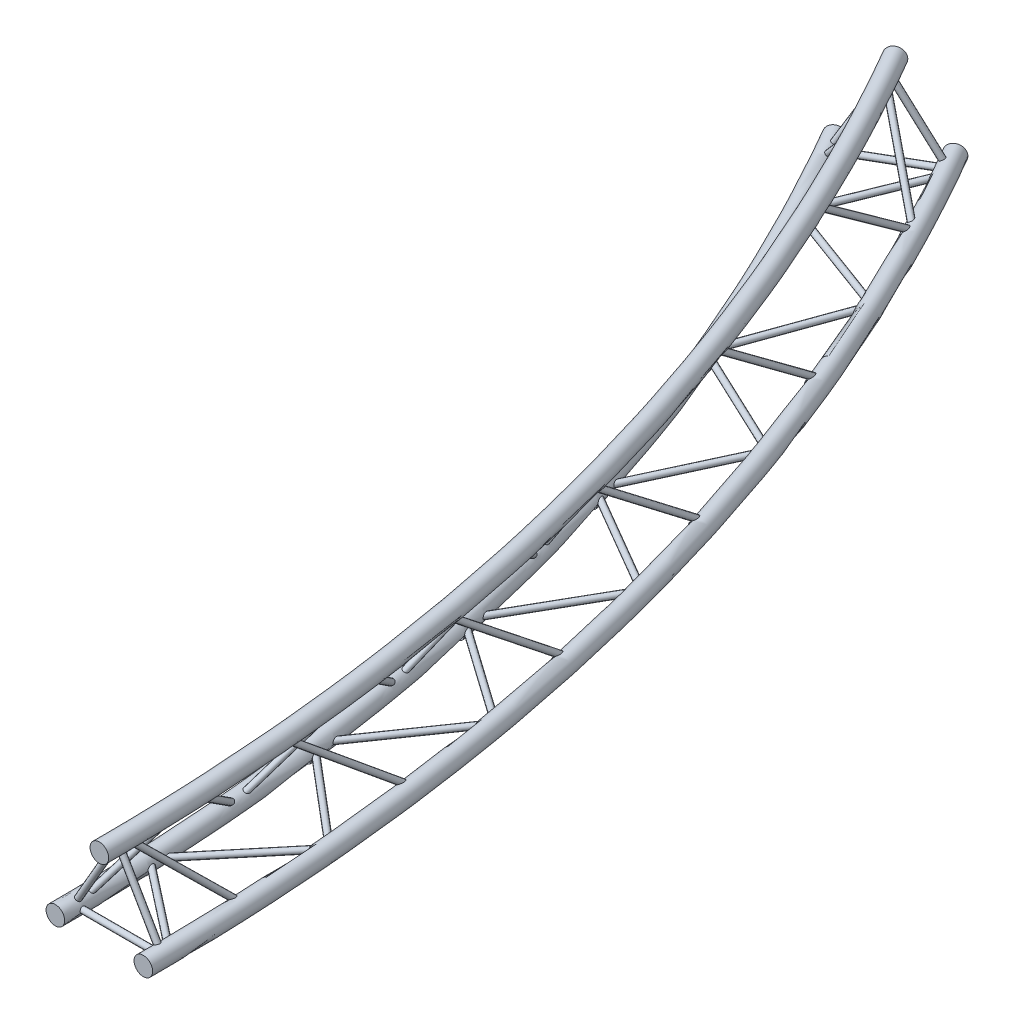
SolidWorks part; units mm, degrees
ref_plane "Face" through (0, 0, 0) normal (0, 0, 1) x (1, 0, 0)
ref_plane "Dessus" through (0, 0, 0) normal (0, 1, 0) x (1, 0, 0)
ref_plane "Droite" through (0, 0, 0) normal (1, 0, 0) x (0, 0, -1)
sketch "Esquisse1" plane through (0, 0, 0) normal (0, 0, 1) x (1, 0, 0)
  line L0 (5856.5, 136.832) -> (5738, -68.416) construction
  line L1 (5738, -68.416) -> (5975, -68.416) construction
  line L2 (5975, -68.416) -> (5856.5, 136.832) construction
  line L3 (5856.5, 61.5908) -> (5856.5, -61.5908) construction
  line L4 (72.9361, 0) -> (11640.0639, 0) construction
  line L5 (5856.5, 0) -> (5856.5, 136.832)
  line L8 (6000, -68.416) -> (6000, 207.9766) construction
  line L9 (0, 252.4415) -> (0, -235.2114) construction
  circle A0 centre (5856.5, 0) radius 136.832 construction
  circle A1 centre (5856.5, 136.832) radius 25
  circle A2 centre (5738, -68.416) radius 25
  circle A3 centre (5975, -68.416) radius 25
  dimension "D1" = 90
  dimension "D2" = 50
  dimension "D3" = 237
  dimension "D4" = 6000
revolve "Révolution1" add sketch "Esquisse1" angle 30 about L9
ref_point "Point1"
ref_plane "Plan1" through (0, -68.416, 0) normal (0, 1, 0) x (-1, 0, 0)
sketch "cercle1" plane through (0, -68.416, 0) normal (0, 1, 0) x (-1, 0, 0)
  circle A0 centre (0, 0) radius 5738
ref_point "Point2"
ref_plane "Plan2" through (0, -68.416, 0) normal (0, 1, 0) x (-1, 0, 0)
sketch "cercle2" plane through (0, -68.416, 0) normal (0, 1, 0) x (-1, 0, 0)
  circle A0 centre (0, 0) radius 5975
ref_point "Point3"
ref_plane "Plan3" through (0, 136.832, 0) normal (0, 1, 0) x (-1, 0, 0)
sketch "cercle3" plane through (0, 136.832, 0) normal (0, 1, 0) x (-1, 0, 0)
  circle A0 centre (0, 0) radius 5856.5
ref_point "Point4"
ref_plane "Plan4" through (0, 0, 0) normal (0, 1, 0) x (-1, 0, 0)
sketch "cercle4" plane through (0, 0, 0) normal (0, 1, 0) x (-1, 0, 0)
  circle A0 centre (0, 0) radius 5856.5
ref_plane "plan_sym" through (0, 0, 0) normal (0.2588, 0, 0.9659) x (0.9659, 0, -0.2588)
sketch3d "Esquisse3D1"
  line L0 (5856.2866, 136.832, -49.9995) -> (5737.7821, -68.416, -50)
  line L1 (5737.7821, -68.416, -50) -> (5974.7908, -68.416, -49.9996)
  line L2 (5974.7908, -68.416, -49.9996) -> (5856.2866, 136.832, -49.9995)
  line L3 (5738, -68.416, 0) -> (5975, -68.416, 0) construction
  circle A0 centre (0, 136.832, 0) radius 5856.5 construction
  circle A1 centre (0, -68.416, 0) radius 5738 construction
  circle A2 centre (0, -68.416, 0) radius 5975 construction
  circle A3 centre (5856.5, 136.832, 0) radius 25 construction
  point P4 (0, 5993.332, 0)
  point P7 (0, 5669.584, 0)
  point P11 (0, 5906.584, 0)
  point P14 (5856.5, 136.832, 25)
  dimension "D1" = 50
  dimension "D2" = 50
  dimension "D3" = 50
ref_plane "Plan6" through (5737.7821, -68.416, -50) normal (-0.5, -0.866, 0) x (0.866, -0.5, -0.0001)
sketch "Esquisse8" plane through (5737.7821, -68.416, -50) normal (-0.5, -0.866, 0) x (0.866, -0.5, -0.0001)
  circle A0 centre (0, 0) radius 8
sweep "treilli droit départ" add profiles "Esquisse8" path "Esquisse3D1"
mirror "treilli droit fin" about plane through (0, 0, 0) normal (0.2588, 0, 0.9659) of "treilli droit départ"
sketch3d "Esquisse3D2"
  line L0 (5974.59, -68.416, -69.9988) -> (5732.1081, -68.416, -259.963)
  line L1 (5738, -68.416, 0) -> (5975, -68.416, 0) construction
  circle A0 centre (0, -68.416, 0) radius 5975 construction
  circle A1 centre (0, -68.416, 0) radius 5738 construction
  point P4 (0, 5906.584, 0)
  point P7 (0, 5669.584, 0)
  dimension "D1" = 70
  dimension "D2" = 259.963
ref_plane "Plan7" through (5732.1081, -68.416, -259.963) normal (-0.7872, 0, -0.6167) x (-0.6167, 0, 0.7872)
sketch "Esquisse9" plane through (5732.1081, -68.416, -259.963) normal (-0.7872, 0, -0.6167) x (-0.6167, 0, 0.7872)
  circle A0 centre (0, 0) radius 8
  dimension "D1" = 16
sweep "treilli depart 1" add profiles "Esquisse9" path "Esquisse3D2"
sketch3d "Esquisse3D3"
  line L0 (5737.573, -68.416, -69.9987) -> (5850.7303, 136.832, -259.899)
  circle A0 centre (0, -68.416, 0) radius 5738 construction
  circle A1 centre (0, 136.832, 0) radius 5856.5 construction
  point P4 (0, 5669.584, 0)
  point P7 (0, 5993.332, 0)
  dimension "D1" = 70
  dimension "D2" = 259.963
ref_plane "Plan8" through (5737.573, -68.416, -69.9987) normal (0.3751, 0.6804, -0.6295) x (-0.9257, 0.311, -0.2155)
sketch "Esquisse10" plane through (5737.573, -68.416, -69.9987) normal (0.3751, 0.6804, -0.6295) x (-0.9257, 0.311, -0.2155)
  circle A0 centre (0, 0) radius 8
  dimension "D1" = 16
sweep "treilli depart 2" add profiles "Esquisse10" path "Esquisse3D3"
sketch3d "Esquisse3D4"
  line L0 (5856.0817, 136.832, -69.9987) -> (5968.4411, -68.416, -279.8862)
  circle A0 centre (0, 136.832, 0) radius 5856.5 construction
  circle A1 centre (0, -68.416, 0) radius 5975 construction
  point P4 (0, 5993.332, 0)
  point P7 (0, 5906.584, 0)
  dimension "D1" = 279.963
  dimension "D2" = 70
ref_plane "Plan9" through (5968.4411, -68.416, -279.8862) normal (0.3575, -0.653, -0.6677) x (0.9317, 0.2982, 0.2071)
sketch "Esquisse11" plane through (5968.4411, -68.416, -279.8862) normal (0.3575, -0.653, -0.6677) x (0.9317, 0.2982, 0.2071)
  circle A0 centre (0, 0) radius 8
  dimension "D1" = 16
sweep "treilli depart 3" add profiles "Esquisse11" path "Esquisse3D4"
mirror "treillis fin" about plane through (0, 0, 0) normal (0.2588, 0, 0.9659) of "treilli depart 1", "treilli depart 2", "treilli depart 3"
sketch3d "Esquisse3D6"
  line L0 (5850.7303, 136.832, -259.899) -> (5715.8564, -68.416, -503.6166)
  line L1 (5836.5275, 111.0705, -236.0638) -> (5747.7268, -49.9988, -87.0387) construction
  circle A0 centre (0, 136.832, 0) radius 5856.5 construction
  circle A1 centre (0, -68.416, 0) radius 5738 construction
  point P4 (0, 5993.332, 0)
  point P7 (0, 5669.584, 0)
  dimension "D1" = 346
ref_plane "Plan11" through (5715.8564, -68.416, -503.6166) normal (-0.3898, -0.5932, -0.7044) x (0.9164, -0.3254, -0.2331)
sketch "Esquisse12" plane through (5715.8564, -68.416, -503.6166) normal (-0.3898, -0.5932, -0.7044) x (0.9164, -0.3254, -0.2331)
  circle A0 centre (0, 0) radius 8
  dimension "D1" = 16
sweep "treilli int 1" add profiles "Esquisse12" path "Esquisse3D6"
ref_plane "Plan10" through (0, 0, 0) normal (0.0878, 0, 0.9961) x (0.9961, 0, -0.0878)
sketch3d "Esquisse3D7"
  line L2 (5923.4738, -68.416, -782.996) -> (5833.8991, 136.832, -514.0172)
  circle A0 centre (0, 136.832, 0) radius 5856.5 construction
  circle A1 centre (0, -68.416, 0) radius 5975 construction
  point P4 (0, 5993.332, 0)
  point P5 (0, 5906.584, 0)
  dimension "D1" = 350
ref_plane "Plan12" through (5833.8991, 136.832, -514.0172) normal (-0.2559, 0.5864, 0.7685) x (-0.5575, -0.739, 0.3783)
sketch "Esquisse13" plane through (5833.8991, 136.832, -514.0172) normal (-0.2559, 0.5864, 0.7685) x (-0.5575, -0.739, 0.3783)
  circle A0 centre (0, 0) radius 8
  dimension "D1" = 16
sweep "treilli int 2" add profiles "Esquisse13" path "Esquisse3D7"
sketch3d "Esquisse3D9"
  line L0 (5732.1081, -68.416, -259.963) -> (5951.9418, -68.416, -524.4178)
  line L1 (5954.4013, -68.416, -85.8149) -> (5762.0889, -68.416, -236.4755) construction
  circle A0 centre (0, -68.416, 0) radius 5738 construction
  circle A1 centre (0, -68.416, 0) radius 5975 construction
  point P4 (0, 5669.584, 0)
  point P7 (0, 5906.584, 0)
  dimension "D1" = 343.8941
ref_plane "Plan13" through (5732.1081, -68.416, -259.963) normal (0.6392, 0, -0.769) x (-0.769, 0, -0.6392)
sketch "Esquisse14" plane through (5732.1081, -68.416, -259.963) normal (0.6392, 0, -0.769) x (-0.769, 0, -0.6392)
  circle A0 centre (0, 0) radius 8
  dimension "D1" = 16
sweep "treilli int 3" add profiles "Esquisse14" path "Esquisse3D9"
sketch3d "Esquisse3D10"
  line L0 (5806.0359, 136.832, -767.1634) -> (5715.8564, -68.416, -503.6166)
  circle A0 centre (0, 136.832, 0) radius 5856.5 construction
  circle A1 centre (0, -68.416, 0) radius 5738 construction
  point P4 (0, 5993.332, 0)
  point P7 (0, 5669.584, 0)
  dimension "D1" = 346
ref_plane "Plan14" through (5806.0359, 136.832, -767.1634) normal (-0.2606, -0.5932, 0.7617) x (0.961, -0.0838, 0.2636)
sketch "Esquisse15" plane through (5806.0359, 136.832, -767.1634) normal (-0.2606, -0.5932, 0.7617) x (0.961, -0.0838, 0.2636)
  circle A0 centre (0, 0) radius 8
  dimension "D1" = 16
sweep "treilli int4" add profiles "Esquisse15" path "Esquisse3D10"
sketch3d "Esquisse3D11"
  line L0 (5833.8991, 136.832, -514.0172) -> (5923.4738, -68.416, -782.996)
  circle A0 centre (0, -68.416, 0) radius 5975 construction
  point P5 (0, 5906.584, 0)
  dimension "D1" = 350
ref_plane "Plan15" through (5923.4738, -68.416, -782.996) normal (0.2559, -0.5864, -0.7685) x (-0.96, -0.0604, -0.2736)
sketch "Esquisse16" plane through (5923.4738, -68.416, -782.996) normal (0.2559, -0.5864, -0.7685) x (-0.96, -0.0604, -0.2736)
  circle A0 centre (0, 0) radius 8
  dimension "D1" = 16
sweep "treilli int 5" add profiles "Esquisse16" path "Esquisse3D11"
sketch3d "Esquisse3D12"
  line L0 (5951.9418, -68.416, -524.4178) -> (5689.2525, -68.416, -746.3581)
  circle A0 centre (0, -68.416, 0) radius 5738 construction
  point P5 (0, 5669.584, 0)
  dimension "D1" = 343.8941
ref_plane "Plan16" through (5951.9418, -68.416, -524.4178) normal (-0.7639, 0, -0.6454) x (-0.6454, 0, 0.7639)
sketch "Esquisse17" plane through (5951.9418, -68.416, -524.4178) normal (-0.7639, 0, -0.6454) x (-0.6454, 0, 0.7639)
  circle A0 centre (0, 0) radius 8
  dimension "D1" = 16
sweep "treilli int 6" add profiles "Esquisse17" path "Esquisse3D12"
sketch "Esquisse19" plane through (0, 0, 0) normal (0, 1, 0) x (1, 0, 0)
  line L0 (5715.8564, 503.6166) -> (0, 0)
  line L1 (0, 0) -> (5850.7303, 259.899)
  line L2 (5836.5275, 236.0638) -> (5747.7268, 87.0387) construction
  line L3 (-267.1741, -23.5404) -> (267.1741, 23.5404) construction
  line L4 (5833.3914, 291.2305) -> (5733.2215, 472.2378) construction
  circle A1 centre (0, 0) radius 5738 construction
  circle A2 centre (0, 0) radius 5856.5 construction
  dimension "D1" = 2.492
pattern_circular "Répétition circulaire1" count 5 every 4.984 of "treilli int 1", "treilli int 3", "treilli int 2"
pattern_circular "Répétition circulaire2" count 5 every 4.984 of "treilli int4", "treilli int 6", "treilli int 5"
sketch3d "Esquisse3D13"
  line L0 (5106.5155, 136.832, -2867.419) -> (5094.1327, -68.416, -2640.9195)
  circle A0 centre (0, 136.832, 0) radius 5856.5 construction
  circle A1 centre (0, -68.416, 0) radius 5738 construction
  point P4 (0, 5993.332, 0)
  point P7 (0, 5669.584, 0)
  dimension "D1" = 259.963
  dimension "D2" = 70
ref_plane "Plan17" through (5106.5155, 136.832, -2867.419) normal (-0.0405, -0.6709, 0.7404) x (0.7399, 0.4779, 0.4735)
sketch "Esquisse21" plane through (5106.5155, 136.832, -2867.419) normal (-0.0405, -0.6709, 0.7404) x (0.7399, 0.4779, 0.4735)
  circle A0 centre (0, 0) radius 8
  dimension "D1" = 16
sweep "treilli sym 1" [suppressed] add profiles "Esquisse21" path "Esquisse3D13"
sketch3d "Esquisse3D14"
  line L0 (5206.0608, 136.832, -2682.4472) -> (5209.1467, -68.416, -2926.6732)
  circle A0 centre (0, 136.832, 0) radius 5856.5 construction
  circle A1 centre (0, -68.416, 0) radius 5975 construction
  point P4 (0, 5993.332, 0)
  point P7 (0, 5906.584, 0)
  dimension "D1" = 70
  dimension "D2" = 279.963
ref_plane "Plan18" [suppressed] through (-972.4839, -68.416, -70) normal (-0.4895, -0.6544, 0.5764) x (0.8685, -0.3063, 0.3898)
sketch "Esquisse22" [suppressed] plane through (-972.4839, -68.416, -70) normal (-0.4895, -0.6544, 0.5764) x (0.8685, -0.3063, 0.3898)
  circle A0 centre (-5.0885, 0) radius 8
  dimension "D1" = 16
sweep "treilli sym 2" [suppressed] add profiles "Esquisse22" path "Esquisse3D14"
sketch3d "Esquisse3D15"
  line L0 (5039.6534, -68.416, -3209.7536) -> (5003.884, -68.416, -2808.1647)
  circle A0 centre (0, -68.416, 0) radius 5975 construction
  circle A1 centre (0, -68.416, 0) radius 5738 construction
  circle A3 centre (5174.5018, -68.416, -2987.5) radius 25 construction
  point P4 (0, 5906.584, 0)
  point P7 (0, 5669.584, 0)
  point P13 (5187.0018, -68.416, -2965.8494)
  dimension "D1" = 70
  dimension "D2" = 259.963
ref_plane "Plan19" [suppressed] through (-947.6836, -68.416, -229.1741) normal (0.8011, 0, 0.5986) x (0.5986, 0, -0.8011)
sketch "Esquisse23" [suppressed] plane through (-947.6836, -68.416, -229.1741) normal (0.8011, 0, 0.5986) x (0.5986, 0, -0.8011)
  circle A0 centre (0, 0) radius 8
  dimension "D1" = 16
sweep "treilli sym 3" [suppressed] add profiles "Esquisse23" path "Esquisse3D15"
equation "\"D1@plan_sym\"=\"D1@Révolution1\"/2"
equation "\"pas_theorique\"=500"
equation "\"demi_pas_theorique\"=\"pas_theorique\"/2"
equation "\"nb_demi_pas_theorique\"=(2*\"D4@Esquisse1\"* pi -2*70)/(\"demi_pas_theorique\")"
equation "\"nb_arche\"=360/\"D1@Révolution1\""
equation "\"nb_demi_pas_th_2\"=\"nb_demi_pas_theorique\"/\"nb_arche\""
equation "\"nb_demi_pas_entier\"=int(\"nb_demi_pas_th_2\")-1"
equation "\"D2@Esquisse3D2\" = 70+(\"nb_demi_pas_th_2\"-\"nb_demi_pas_entier\")*\"pas_theorique\"/4"
equation "\"D2@Esquisse3D3\" = \"D2@Esquisse3D2\""
equation "\"D1@Esquisse3D4\"=\"D2@Esquisse3D2\"+20"
equation "\"D1@Esquisse3D10\" = \"D1@Esquisse3D6\""
equation "\"D1@Esquisse3D11\" = \"D1@Esquisse3D7\""
equation "\"D1@Esquisse3D12\" = \"D1@Esquisse3D9\""
equation "\"D2@Répétition circulaire1\"=\"D1@Esquisse19\"*2"
equation "\"D1@Esquisse3D13\" = \"D2@Esquisse3D2\""
equation "\"D2@Esquisse3D14\" = \"D1@Esquisse3D4\""
equation "\"D2@Esquisse3D15\" = \"D2@Esquisse3D3\""
equation "\"D2@Répétition circulaire2\" = \"D1@Esquisse19\"*2"
